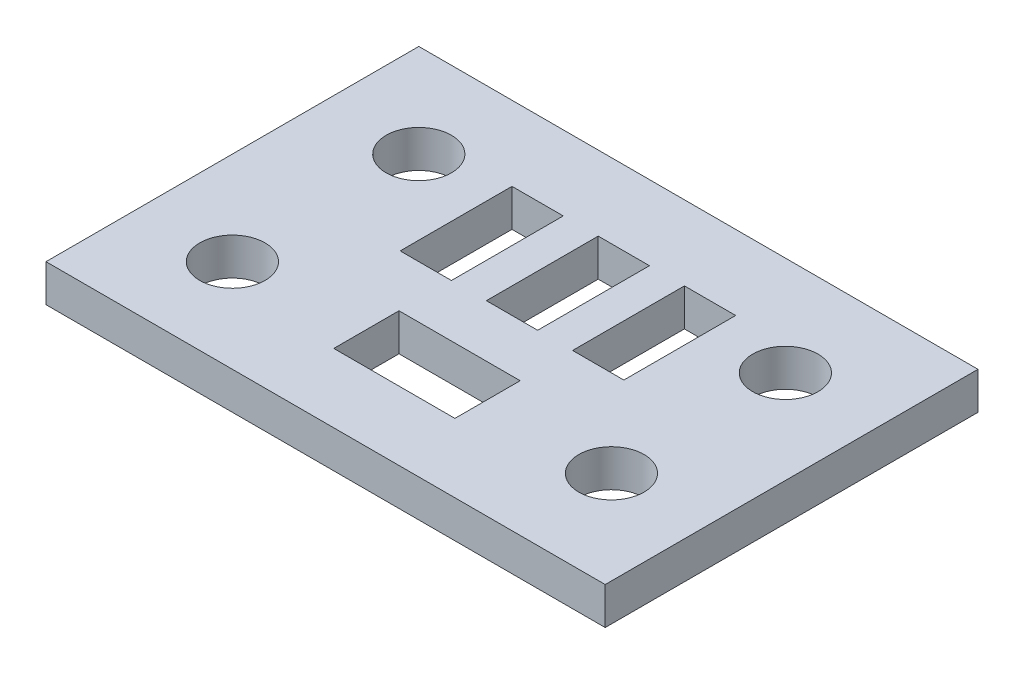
SolidWorks part; units mm, degrees
ref_plane "Plan de face" through (0, 0, 0) normal (0, 0, 1) x (1, 0, 0)
ref_plane "Plan de dessus" through (0, 0, 0) normal (0, 1, 0) x (1, 0, 0)
ref_plane "Plan de droite" through (0, 0, 0) normal (1, 0, 0) x (0, 0, -1)
sketch "Esquisse1" plane through (0, 0, 0) normal (0, 1, 0) x (1, 0, 0)
  line L0 (0, 10) -> (9, 10) construction
  line L1 (0, 0) -> (30, 0)
  line L2 (0, 0) -> (0, 20)
  line L3 (0, 20) -> (30, 20)
  line L4 (30, 0) -> (30, 20)
  line L5 (15, 20) -> (15, 0) construction
  line L6 (11.75, 10) -> (11.75, 16)
  line L7 (11.75, 7.188) -> (18.25, 7.188)
  line L8 (11.75, 7.188) -> (11.75, 3.688)
  line L9 (11.75, 3.688) -> (18.25, 3.688)
  line L10 (18.25, 7.188) -> (18.25, 3.688)
  line L11 (11.75, 10) -> (9, 10)
  line L12 (9, 10) -> (9, 16)
  line L13 (9, 16) -> (11.75, 16)
  line L14 (21, 16) -> (21, 10)
  line L15 (13.625, 10) -> (13.625, 16)
  line L16 (16.375, 10) -> (16.375, 16)
  line L17 (18.25, 10) -> (18.25, 16)
  line L18 (13.625, 16) -> (16.375, 16)
  line L19 (13.625, 10) -> (16.375, 10) construction
  line L20 (13.625, 10) -> (16.375, 10)
  line L21 (18.25, 10) -> (21, 10)
  line L22 (18.25, 10) -> (30, 10) construction
  line L23 (18.25, 16) -> (21, 16)
  circle A0 centre (5, 15) radius 1.75
  circle A1 centre (25, 14.6656) radius 1.75
  circle A2 centre (25, 5.3344) radius 1.75
  circle A3 centre (5, 5) radius 1.75
  point P17 (15, 13)
  dimension "D3" = 3.5
  dimension "D9" = 2
  dimension "D13" = 3.5
  dimension "D1" = 20
  dimension "D2" = 30
  dimension "D4" = 20
  dimension "D5" = 20
  dimension "D6" = 10
  dimension "D7" = 10
  dimension "D8" = 5
  dimension "D14" = 6.5
  dimension "D15" = 3.25
  dimension "D17" = 5
  dimension "D19" = 2.75
  dimension "D20" = 2.75
  dimension "D21" = 1.375
extrude "Boss.-Extru.2" add sketch "Esquisse1" along normal blind 2
